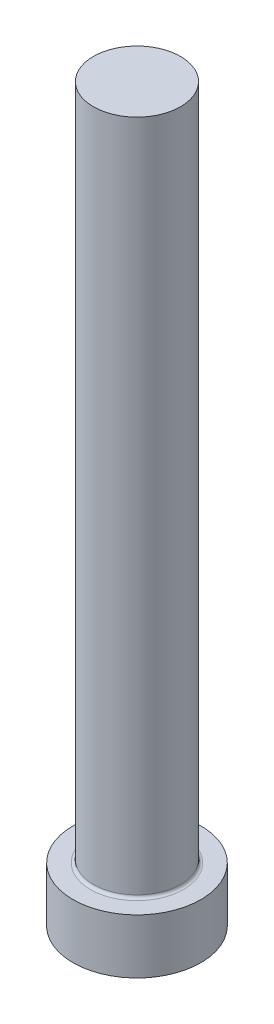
SolidWorks part; units mm, degrees
ref_plane "Front Plane" through (0, 0, 0) normal (0, 0, 1) x (1, 0, 0)
ref_plane "Top Plane" through (0, 0, 0) normal (0, 1, 0) x (1, 0, 0)
ref_plane "Right Plane" through (0, 0, 0) normal (1, 0, 0) x (0, 0, -1)
sketch "Sketch1" plane through (0, 0, 0) normal (0, 0, 1) x (1, 0, 0)
  line L0 (0, 0) -> (0, -1.906) construction
  line L1 (0, 0) -> (5.5499, 0)
  line L2 (5.5499, 0) -> (5.5499, 4.7498)
  line L3 (5.5499, 4.7498) -> (4.0386, 4.7498)
  line L4 (3.7846, 5.0038) -> (3.7846, 63.5)
  line L6 (0, 63.5) -> (3.7846, 63.5)
  line L7 (0, 63.5) -> (0, 0)
  arc A0 (4.0386, 4.7498) -> (3.7846, 5.0038) centre (4.0386, 5.0038) cw
  dimension "D5" = 0.254
  dimension "D" = 7.5692
  dimension "H" = 11.0998
  dimension "D4" = 63.5
  dimension "T" = 4.7498
revolve "Revolve3" add sketch "Sketch1" angle 360 about L0
